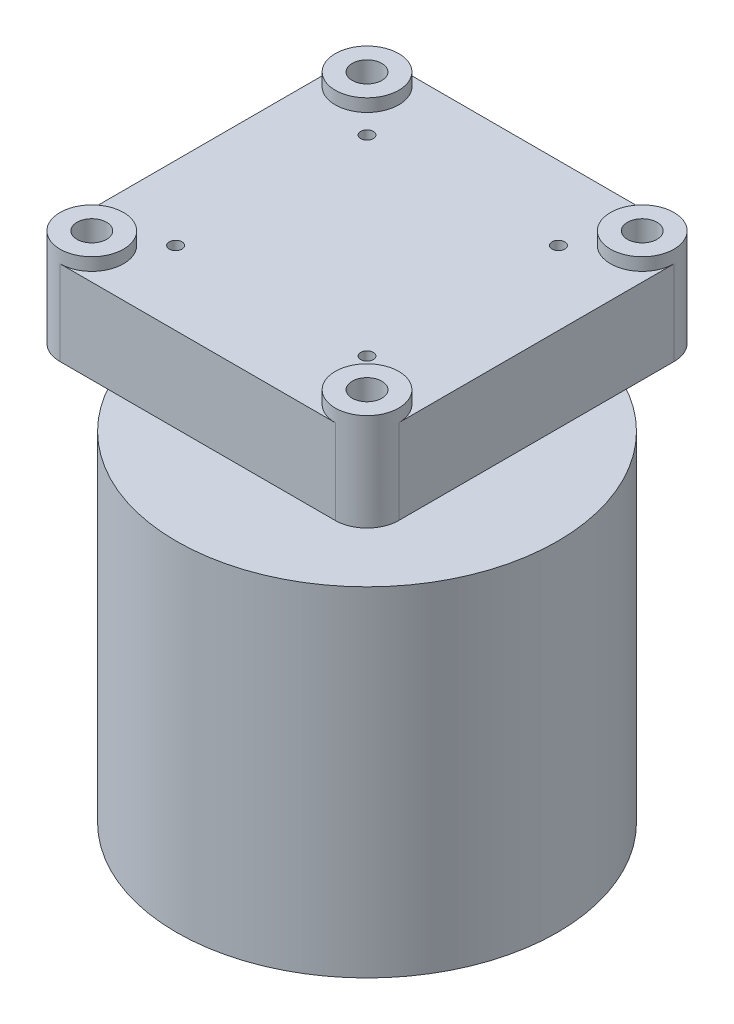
SolidWorks part; units mm, degrees
ref_plane "Front Plane" through (0, 0, 0) normal (0, 0, 1) x (1, 0, 0)
ref_plane "Top Plane" through (0, 0, 0) normal (0, 1, 0) x (1, 0, 0)
ref_plane "Right Plane" through (0, 0, 0) normal (1, 0, 0) x (0, 0, -1)
sketch "Sketch1" plane through (0, 0, 0) normal (0, 1, 0) x (1, 0, 0)
  line L0 (51.9659, 0) -> (-55.8196, 0) construction
  line L1 (-32.5, -40) -> (32.5, -40)
  line L2 (-40, -32.5) -> (-40, 32.5)
  line L3 (-32.5, 40) -> (32.5, 40)
  line L4 (40, -32.5) -> (40, 32.5)
  line L5 (-40, -40) -> (40, 40) construction
  line L6 (-40, 40) -> (40, -40) construction
  line L7 (0, -48.933) -> (0, 55.862) construction
  circle A0 centre (32.5, 32.5) radius 3.5
  circle A1 centre (-32.5, -32.5) radius 3.5
  circle A2 centre (-32.5, 32.5) radius 3.5
  circle A3 centre (32.5, -32.5) radius 3.5
  arc A5 (-32.5, -40) -> (-40, -32.5) centre (-32.5, -32.5) cw
  arc A6 (32.5, -40) -> (40, -32.5) centre (32.5, -32.5) ccw
  arc A7 (32.5, 40) -> (40, 32.5) centre (32.5, 32.5) cw
  arc A8 (-40, 32.5) -> (-32.5, 40) centre (-32.5, 32.5) cw
  circle A9 centre (22.6005, -22.6005) radius 1.5
  circle A10 centre (-22.6005, -22.6005) radius 1.5
  circle A11 centre (-22.6005, 22.6005) radius 1.5
  circle A12 centre (22.6005, 22.6005) radius 1.5
  point P0 (0, 0)
  point P38 (0, 0)
  dimension "D3" = 7
  dimension "D5" = 7.5
  dimension "D6" = 3
  dimension "D7" = 14
  dimension "D1" = 80
  dimension "D2" = 80
  dimension "D4" = 7.5
extrude "Boss-Extrude1" add sketch "Sketch1" along normal blind 20
sketch "Sketch2" plane through (0, 0, 0) normal (0, -1, 0) x (1, 0, 0)
  circle A0 centre (0, 0) radius 17.5
extrude "Boss-Extrude2" add sketch "Sketch2" along normal blind 18
sketch "Sketch3" plane through (0, -18, 0) normal (0, -1, 0) x (1, 0, 0)
  circle A0 centre (0, 0) radius 45
extrude "Boss-Extrude3" add sketch "Sketch3" along normal blind 80
sketch "Sketch4" plane through (0, 20, 0) normal (0, 1, 0) x (1, 0, 0)
  line L0 (37.9809, 0) -> (-39.1715, 0) construction
  line L1 (0, 43.4251) -> (0, -51.6078) construction
  circle A0 centre (32.5, 32.5) radius 7.5
  circle A1 centre (32.5, -32.5) radius 7.5
  circle A4 centre (32.5, 32.5) radius 3.5
  circle A5 centre (32.5, -32.5) radius 3.5
  circle A8 centre (-32.5, -32.5) radius 3.5
  circle A9 centre (-32.5, -32.5) radius 7.5
  circle A10 centre (-32.5, 32.5) radius 3.5
  circle A11 centre (-32.5, 32.5) radius 7.5
extrude "Boss-Extrude5" add sketch "Sketch4" along normal blind 3
